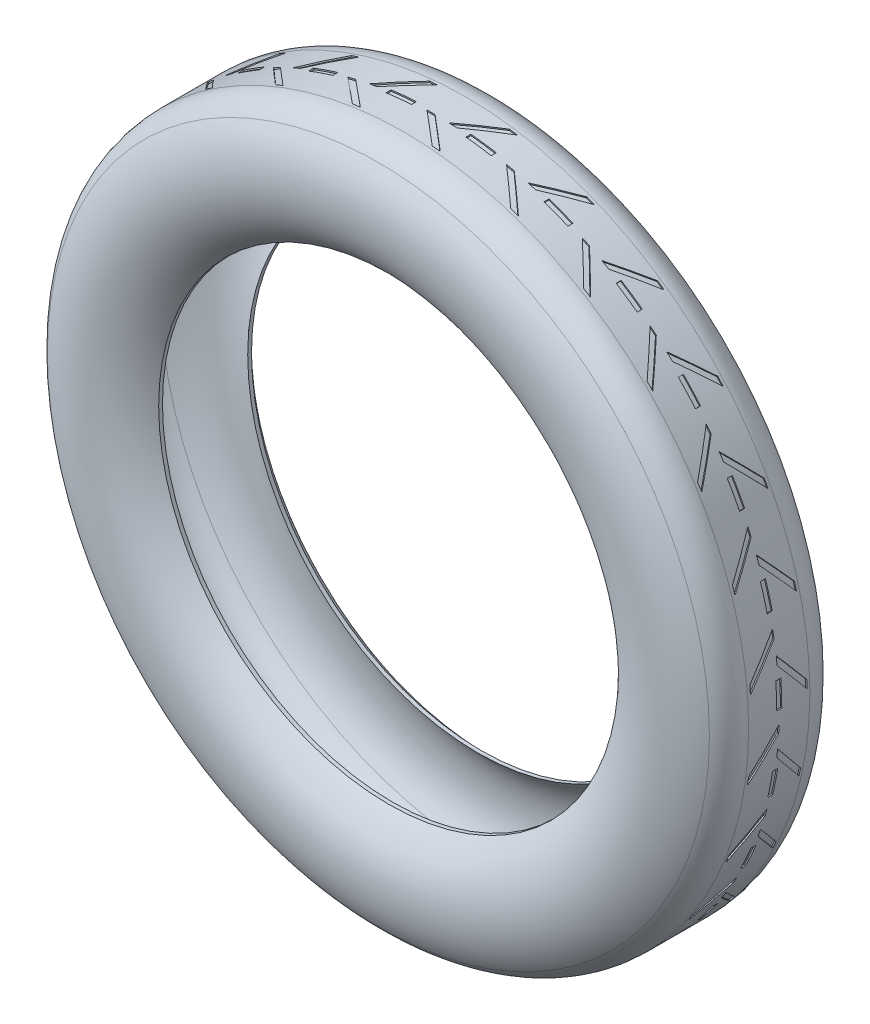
SolidWorks part; units mm, degrees
ref_plane "Front Plane" through (0, 0, 0) normal (0, 0, 1) x (1, 0, 0)
ref_plane "Top Plane" through (0, 0, 0) normal (0, 1, 0) x (1, 0, 0)
ref_plane "Right Plane" through (0, 0, 0) normal (1, 0, 0) x (0, 0, -1)
sketch "Sketch1" plane through (0, 0, 0) normal (1, 0, 0) x (0, 0, -1)
  line L0 (-238.8817, 0) -> (254.3572, 0) construction
  line L1 (0, 366.0243) -> (0, -377.1172) construction
  line L2 (-30.5, 342.9) -> (30.5, 342.9)
  line L5 (-46.2254, 229) -> (46.2254, 229)
  arc A0 (-56.3938, 329.7019) -> (-46.2254, 229) centre (5.1039, 285.0473) ccw
  arc A1 (56.3938, 329.7019) -> (46.2254, 229) centre (-5.1039, 285.0473) cw
  arc A2 (30.5, 342.9) -> (56.3938, 329.7019) centre (30.5, 310.9) cw
  arc A3 (-30.5, 342.9) -> (-56.3938, 329.7019) centre (-30.5, 310.9) ccw
  dimension "D2" = 685.8
  dimension "D4" = 76
  dimension "D1" = 32
  dimension "D3" = 458
  dimension "D5" = 61
  dimension "D6" = 83.5
revolve "Revolve1" add sketch "Sketch1" angle 360 about L0
shell "Shell1" thickness 2.5
ref_plane "Plane1" through (0, 355.6, 0) normal (0, 1, 0) x (-1, 0, 0)
sketch "Sketch4" plane through (0, 355.6, 0) normal (0, 1, 0) x (-1, 0, 0)
  line L0 (0, 0) -> (146.9278, 0) construction
  line L1 (0, 0) -> (-32.9399, 27.6399)
  line L3 (-32.9399, 27.6399) -> (-24.9399, 27.6399)
  line L4 (-24.9399, 27.6399) -> (8, 0)
  line L5 (8, 0) -> (0, 0)
  line L6 (58, 0) -> (25.0601, -27.6399)
  line L8 (25.0601, -27.6399) -> (33.0601, -27.6399)
  line L9 (33.0601, -27.6399) -> (66, 0)
  line L10 (66, 0) -> (58, 0)
  line L12 (21, 2.5) -> (46.4, 2.5)
  line L13 (21, 2.5) -> (21, -2.5)
  line L14 (21, -2.5) -> (46.4, -2.5)
  line L15 (46.4, 2.5) -> (46.4, -2.5)
  dimension "D1" = 8
  dimension "D2" = 8
  dimension "D3" = 43
  dimension "D4" = 50
  dimension "D5" = 5
  dimension "D6" = 25.4
  dimension "D7" = 13
  dimension "D8" = 140
  dimension "D9" = 140
wrap "Wrap1" sketch "Sketch4" wrap type deboss source sketch "Sketch4" thickness 1.27 parameters "D1"=1.27
pattern_circular "CirPattern1" count 27 over 360 about axis through (0, 0, -46.2254) along (0, 0, 1) of "Wrap1"
